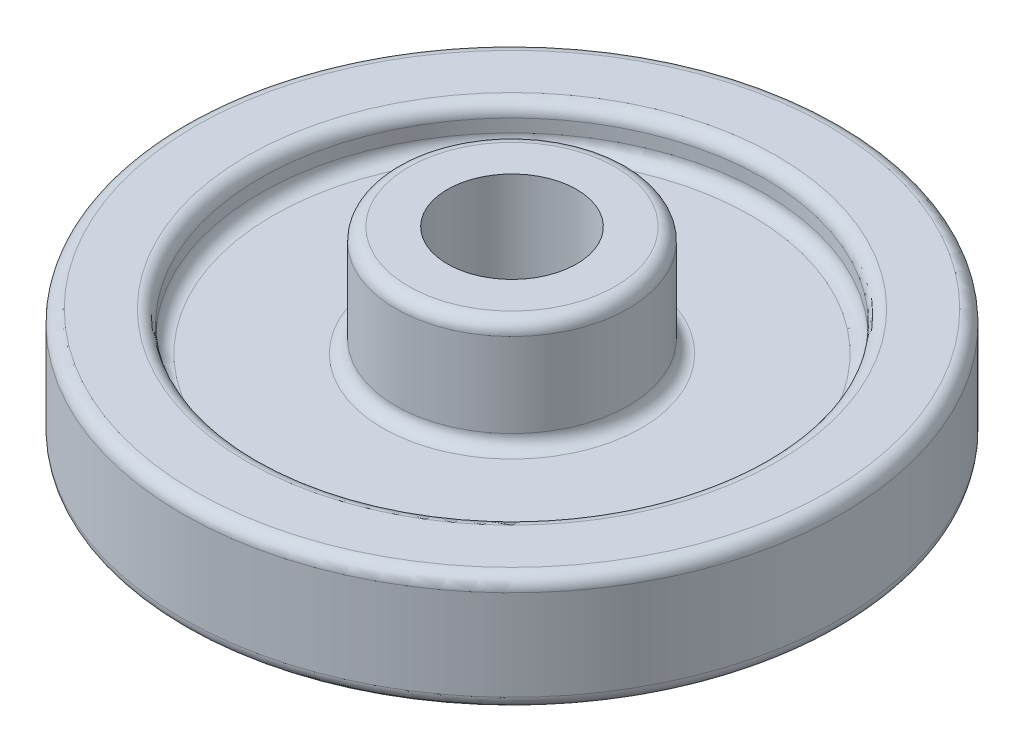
SolidWorks part; units mm, degrees
ref_plane "front" through (0, 0, 0) normal (0, 0, 1) x (1, 0, 0)
ref_plane "top" through (0, 0, 0) normal (0, 1, 0) x (1, 0, 0)
ref_plane "right" through (0, 0, 0) normal (1, 0, 0) x (0, 0, -1)
sketch "Sketch1" plane through (0, 0, 0) normal (0, 0, 1) x (1, 0, 0)
  line L0 (0, 0) -> (0, 66.2679) construction
  line L1 (15.875, 0) -> (15.875, 46.0502)
  line L2 (15.875, 46.0502) -> (25.4, 46.0502)
  line L3 (28.575, 42.8752) -> (28.575, 22.225)
  line L4 (31.75, 19.05) -> (58.7375, 19.05)
  line L5 (61.9125, 22.225) -> (61.9125, 25.4)
  line L6 (65.0875, 28.575) -> (77.7875, 28.575)
  line L7 (80.9625, 25.4) -> (80.9625, 3.175)
  line L8 (77.7875, 0) -> (65.0875, 0)
  line L9 (28.575, 0) -> (28.575, 6.35)
  line L10 (31.75, 9.525) -> (58.7375, 9.525)
  line L11 (61.9125, 6.35) -> (61.9125, 3.175)
  line L12 (28.575, 0) -> (15.875, 0)
  arc A0 (28.575, 42.8752) -> (25.4, 46.0502) centre (25.4, 42.8752) ccw
  arc A1 (31.75, 19.05) -> (28.575, 22.225) centre (31.75, 22.225) cw
  arc A2 (61.9125, 22.225) -> (58.7375, 19.05) centre (58.7375, 22.225) cw
  arc A3 (65.0875, 28.575) -> (61.9125, 25.4) centre (65.0875, 25.4) ccw
  arc A4 (80.9625, 25.4) -> (77.7875, 28.575) centre (77.7875, 25.4) ccw
  arc A5 (77.7875, 0) -> (80.9625, 3.175) centre (77.7875, 3.175) ccw
  arc A6 (65.0875, 0) -> (61.9125, 3.175) centre (65.0875, 3.175) cw
  arc A7 (61.9125, 6.35) -> (58.7375, 9.525) centre (58.7375, 6.35) ccw
  arc A8 (31.75, 9.525) -> (28.575, 6.35) centre (31.75, 6.35) ccw
  point P19 (28.575, 19.05)
  point P26 (80.9625, 28.575)
  point P29 (80.9625, 0)
  dimension "D9" = 3.175
  dimension "D1" = 31.75
  dimension "D2" = 57.15
  dimension "D3" = 123.825
  dimension "D4" = 161.925
  dimension "D5" = 46.0502
  dimension "D6" = 28.575
  dimension "D7" = 9.525
  dimension "D8" = 9.525
revolve "Base-Revolve" add sketch "Sketch1" angle 360 about L0
